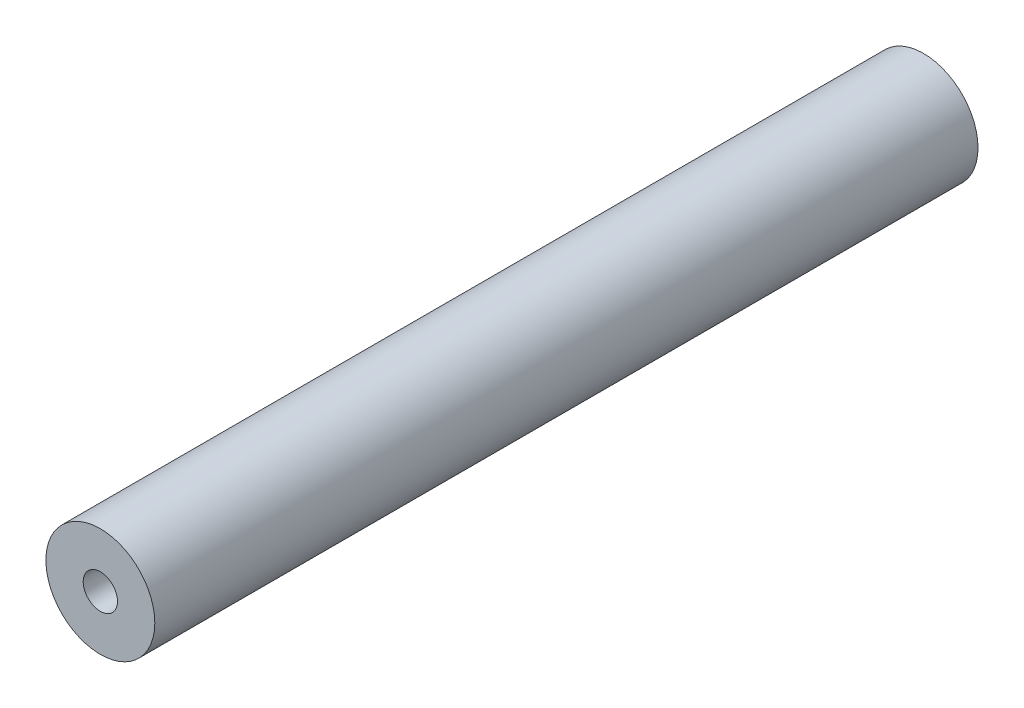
SolidWorks part; units mm, degrees
ref_plane "Front" through (0, 0, 0) normal (0, 0, 1) x (1, 0, 0)
ref_plane "Top" through (0, 0, 0) normal (0, 1, 0) x (1, 0, 0)
ref_plane "Right" through (0, 0, 0) normal (1, 0, 0) x (0, 0, -1)
sketch "Sketch1" plane through (0, 0, 0) normal (0, 0, 1) x (1, 0, 0)
  circle A0 centre (0, 0) radius 3.9688
  dimension "D1" = 7.9375
extrude "Boss-Extrude1" add sketch "Sketch1" along normal mid plane 60
hole_wizard "M3x0.5 Tapped Hole1" positions "Sketch3" profile "Sketch2" tap size "M3x0.5" standard "Ansi Metric"
sketch "Sketch3" plane through (0, 0, 30) normal (0, 0, 1) x (1, 0, 0)
  point P0 (0, 0)
sketch "Sketch2" plane through (0, 0, 30) normal (1, 0, 0) x (0, -1, 0)
  line L0 (0, 0) -> (0, 8.2517)
  line L1 (0, 8.2517) -> (1.25, 7.5006)
  line L2 (1.25, 7.5006) -> (1.25, 0)
  line L5 (1.25, 0) -> (0, 0)
  line L10 (0, 8.2517) -> (-1.25, 7.5006) construction
  line L11 (0, -6.35) -> (0, 107.95) construction
  dimension "Tap Drill Dia." = 2.5
  dimension "Tap Drill Depth" = 7.5006
  dimension "Drill Angle" = 118
hole_wizard "M3x0.5 Tapped Hole2" positions "Sketch5" profile "Sketch4" tap size "M3x0.5" standard "Ansi Metric"
sketch "Sketch5" plane through (0, 0, -30) normal (0, 0, -1) x (-1, 0, 0)
  point P1 (0, 0)
sketch "Sketch4" plane through (0, 0, -30) normal (1, 0, 0) x (0, 1, 0)
  line L0 (0, 0) -> (0, 8.2517)
  line L1 (0, 8.2517) -> (1.25, 7.5006)
  line L2 (1.25, 7.5006) -> (1.25, 0)
  line L5 (1.25, 0) -> (0, 0)
  line L10 (0, 8.2517) -> (-1.25, 7.5006) construction
  line L11 (0, -6.35) -> (0, 107.95) construction
  dimension "Tap Drill Dia." = 2.5
  dimension "Tap Drill Depth" = 7.5006
  dimension "Drill Angle" = 118
